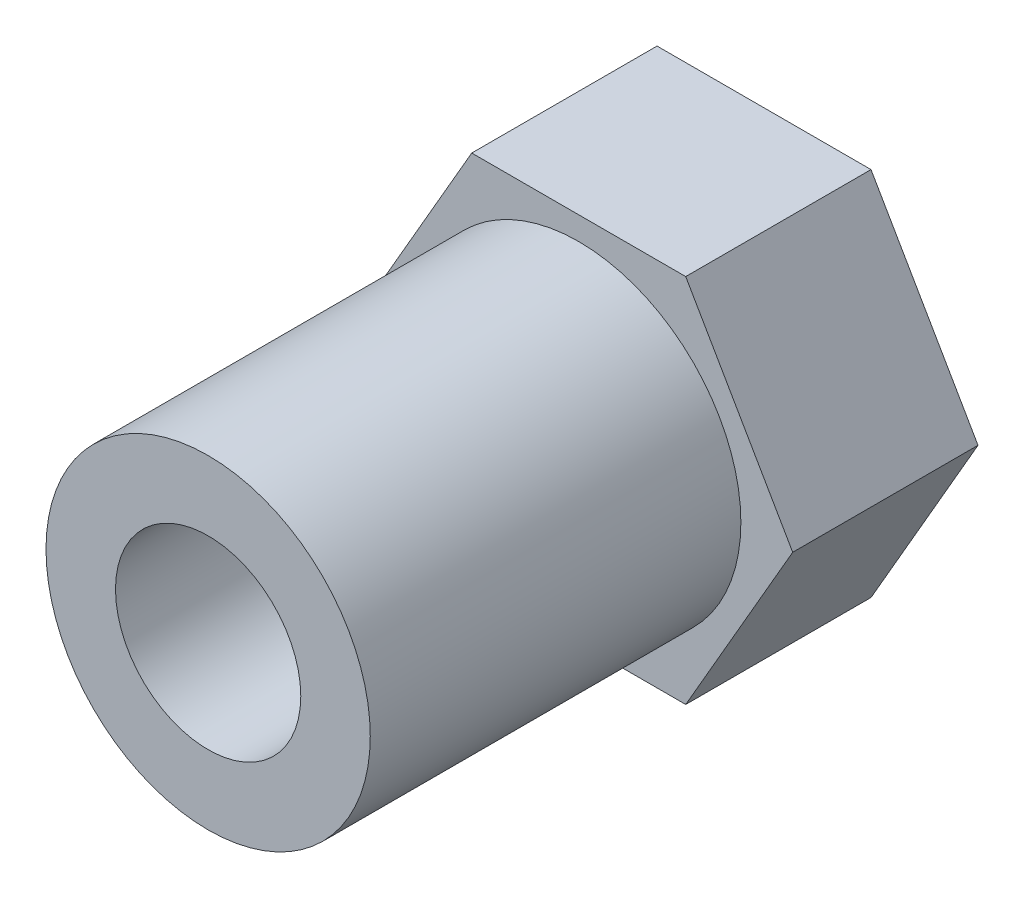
SolidWorks part; units mm, degrees
ref_plane "前视基准面" through (0, 0, 0) normal (0, 0, 1) x (1, 0, 0)
ref_plane "上视基准面" through (0, 0, 0) normal (0, 1, 0) x (1, 0, 0)
ref_plane "右视基准面" through (0, 0, 0) normal (1, 0, 0) x (0, 0, -1)
sketch "草图1" plane through (0, 0, 0) normal (0, 0, 1) x (1, 0, 0)
  line L1 (6.9282, 0) -> (3.4641, 6)
  line L2 (3.4641, 6) -> (-3.4641, 6)
  line L3 (-3.4641, 6) -> (-6.9282, 0)
  line L4 (-6.9282, 0) -> (-3.4641, -6)
  line L5 (-3.4641, -6) -> (3.4641, -6)
  line L6 (3.4641, -6) -> (6.9282, 0)
  circle A0 centre (0, 0) radius 6 construction
  dimension "D1" = 12
extrude "凸台-拉伸1" add sketch "草图1" along normal blind 6
sketch "草图2" plane through (0, 0, 6) normal (0, 0, 1) x (1, 0, 0)
  circle A0 centre (0, 0) radius 5.25
  dimension "D1" = 10.5
extrude "凸台-拉伸2" add sketch "草图2" along normal blind 12
sketch "草图3" plane through (0, 0, 18) normal (0, 0, 1) x (1, 0, 0)
  circle A0 centre (0, 0) radius 3
  dimension "D1" = 6
extrude "切除-拉伸1" cut sketch "草图3" against normal blind 12
sketch "草图5" plane through (0, 0, 6) normal (0, 0, 1) x (1, 0, 0)
  circle A0 centre (0, 0) radius 2
  dimension "D1" = 4
extrude "切除-拉伸2" cut sketch "草图5" against normal blind 10
